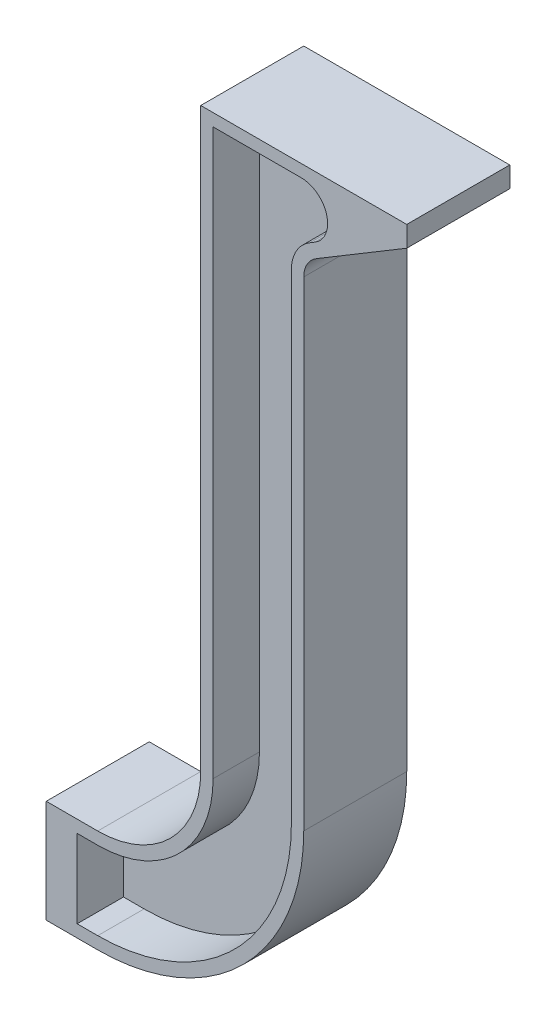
SolidWorks part; units mm, degrees
ref_plane "Front Plane" through (0, 0, 0) normal (0, 0, 1) x (1, 0, 0)
ref_plane "Top Plane" through (0, 0, 0) normal (0, 1, 0) x (1, 0, 0)
ref_plane "Right Plane" through (0, 0, 0) normal (1, 0, 0) x (0, 0, -1)
sketch "Sketch1" plane through (0, 0, 0) normal (0, 0, 1) x (1, 0, 0)
  line L0 (0, 0) -> (25.4, 0)
  line L1 (25.4, 0) -> (25.4, -2.54)
  line L10 (14.2415, -9.2351) -> (25.4, -2.54)
  line L11 (-19.05, -96.52) -> (-19.05, -83.82)
  line L12 (-12.7, -96.52) -> (-19.05, -96.52)
  line L13 (12.7, -11.9577) -> (12.7, -71.12)
  line L14 (-12.7, -83.82) -> (-19.05, -83.82)
  line L15 (0, 0) -> (0, -71.12)
  arc A3 (14.2415, -9.2351) -> (12.7, -11.9577) centre (15.875, -11.9577) ccw
  arc A4 (0, -71.12) -> (-12.7, -83.82) centre (-12.7, -71.12) cw
  arc A5 (12.7, -71.12) -> (-12.7, -96.52) centre (-12.7, -71.12) cw
  dimension "D1" = 25.4
  dimension "D2" = 3.175
  dimension "D4" = 12.7
  dimension "D8" = 6.35
  dimension "D6" = 12.7
  dimension "D3" = 2.54
  dimension "D5" = 96.52
  dimension "D7" = 12.7
  dimension "D9" = 11.9577
extrude "Boss-Extrude1" add sketch "Sketch1" along normal mid plane 12.7
sketch "Sketch2" plane through (0, 0, 6.35) normal (0, 0, 1) x (1, 0, 0)
  line L52 (-15.24, -85.344) -> (-15.24, -94.996)
  line L53 (-19.05, -83.82) -> (-19.05, -96.52) construction
  line L60 (23.876, -1.524) -> (1.524, -1.524)
  line L61 (23.876, -1.6771) -> (23.876, -1.524)
  line L62 (13.4574, -7.9283) -> (23.876, -1.6771)
  line L63 (11.176, -71.12) -> (11.176, -11.9577)
  line L64 (-17.526, -85.344) -> (-17.526, -94.996)
  line L65 (-17.526, -94.996) -> (-12.7, -94.996)
  line L66 (-12.7, -85.344) -> (-17.526, -85.344)
  line L67 (1.524, -1.524) -> (1.524, -71.12)
  line L68 (12.3933, -1.524) -> (1.524, -1.524)
  line L70 (13.4574, -7.9283) -> (14.0661, -7.5631)
  line L71 (11.176, -71.12) -> (11.176, -11.9577)
  line L73 (-15.24, -94.996) -> (-12.7, -94.996)
  line L74 (-12.7, -85.344) -> (-15.24, -85.344)
  line L75 (1.524, -1.524) -> (1.524, -71.12)
  arc A21 (12.3933, -1.524) -> (14.0661, -7.5631) centre (12.3933, -4.7752) cw
  arc A24 (13.4574, -7.9283) -> (11.176, -11.9577) centre (15.875, -11.9577) ccw
  arc A25 (-12.7, -94.996) -> (11.176, -71.12) centre (-12.7, -71.12) ccw
  arc A26 (-12.7, -85.344) -> (1.524, -71.12) centre (-12.7, -71.12) ccw
  arc A27 (13.4574, -7.9283) -> (11.176, -11.9577) centre (15.875, -11.9577) ccw
  arc A28 (-12.7, -94.996) -> (11.176, -71.12) centre (-12.7, -71.12) ccw
  arc A29 (-12.7, -85.344) -> (1.524, -71.12) centre (-12.7, -71.12) ccw
  dimension "D2" = 3.2512
  dimension "D3" = 3.81
  dimension "D1" = 1.524
extrude "Cut-Extrude1" cut sketch "Sketch2" against normal offset from surface (5.715 mm away) 0.635
sketch "Sketch4" plane through (0, 0, 0) normal (0, 0, 1) x (1, 0, 0)
  line L0 (-19.05, -96.52) -> (-36.5123, -96.52) construction
  line L1 (12.7, -71.12) -> (12.7, -210.82)
  line L4 (12.7, -210.82) -> (0, -210.82)
  line L5 (0, -210.82) -> (0, -109.22)
  line L7 (0, 0) -> (0, -71.12) construction
  line L8 (12.7, -11.9577) -> (12.7, -71.12) construction
  line L9 (-12.7, -96.52) -> (-19.05, -96.52) construction
  arc A2 (0, -109.22) -> (-12.7, -96.52) centre (-12.7, -109.22) ccw
  arc A6 (-12.7, -96.52) -> (12.7, -71.12) centre (-12.7, -71.12) ccw
  arc A7 (-12.7, -96.52) -> (12.7, -71.12) centre (-12.7, -71.12) ccw
  dimension "D1" = 101.6
  dimension "D2" = 0
extrude "Boss-Extrude2" [suppressed] add sketch "Sketch4" along normal mid plane 12.7
mirror "Mirror1" about plane through (0, 0, 0) normal (0, 0, 1) of "Cut-Extrude1"
